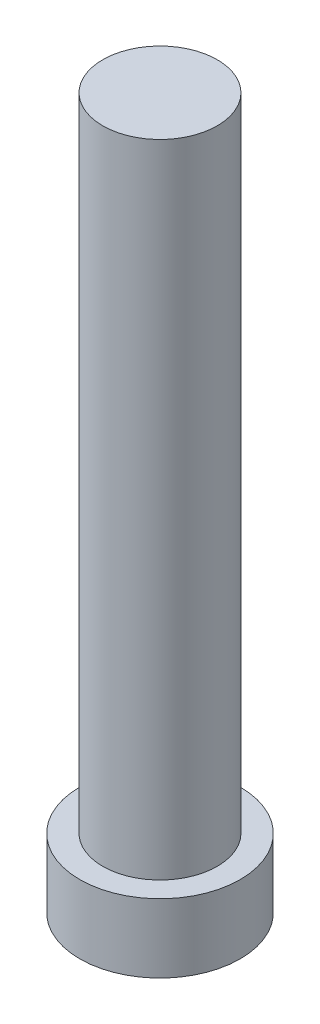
SolidWorks part; units mm, degrees
ref_plane "Face" through (0, 0, 0) normal (0, 0, 1) x (1, 0, 0)
ref_plane "Dessus" through (0, 0, 0) normal (0, 1, 0) x (1, 0, 0)
ref_plane "Droite" through (0, 0, 0) normal (1, 0, 0) x (0, 0, -1)
sketch "Esquisse1" plane through (0, 0, 0) normal (0, 0, 1) x (1, 0, 0)
  line L0 (0, 49.4323) -> (0, -48.5112) construction
  line L1 (0, 0) -> (-7, 0)
  line L2 (-7, 0) -> (-7, 6)
  line L3 (-7, 6) -> (-5, 6)
  line L4 (-5, 6) -> (-5, 62)
  line L5 (-5, 62) -> (0, 62)
  line L6 (0, 62) -> (0, 0)
  dimension "D1" = 62
  dimension "D2" = 6
  dimension "D3" = 14
  dimension "D4" = 5
revolve "Base-Révolution" add sketch "Esquisse1" angle 360 about L0
